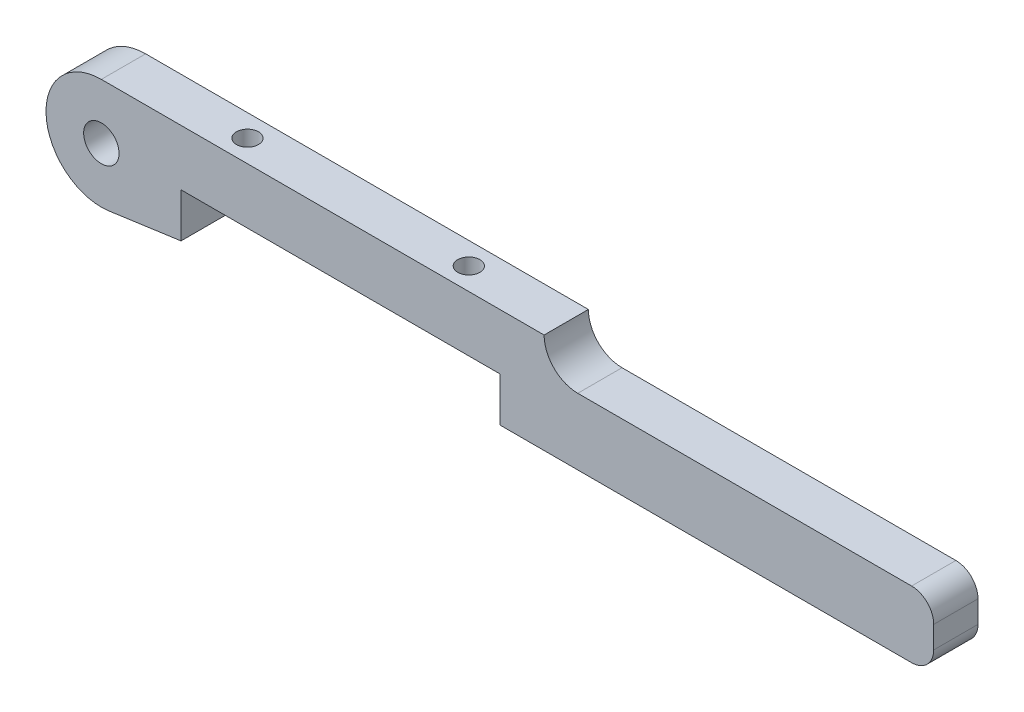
SolidWorks part; units mm, degrees
ref_plane "Front Plane" through (0, 0, 0) normal (0, 0, 1) x (1, 0, 0)
ref_plane "Top Plane" through (0, 0, 0) normal (0, 1, 0) x (1, 0, 0)
ref_plane "Right Plane" through (0, 0, 0) normal (1, 0, 0) x (0, 0, -1)
sketch "Sketch1" plane through (0, 0, 0) normal (0, 0, 1) x (1, 0, 0)
  line L0 (-455.756, 0) -> (22332.0433, 0) construction
  line L1 (0, -455.756) -> (0, 22332.0433) construction
  line L2 (0, 15.875) -> (127, 15.875)
  line L4 (136.652, 6.223) -> (232.41, 6.223)
  line L5 (238.76, -0.127) -> (238.76, -6.477)
  line L6 (232.41, -12.827) -> (114.3, -12.827)
  line L7 (114.3, -12.827) -> (114.3, -0.127)
  line L8 (114.3, -0.127) -> (22.86, -0.127)
  line L9 (22.86, -0.127) -> (22.86, -12.827)
  line L10 (22.86, -12.827) -> (2.2028, -15.7214)
  circle A0 centre (0, 0) radius 5.08
  arc A1 (0, 15.875) -> (2.2028, -15.7214) centre (0, 0) ccw
  arc A2 (238.76, -6.477) -> (232.41, -12.827) centre (232.41, -6.477) cw
  arc A3 (232.41, 6.223) -> (238.76, -0.127) centre (232.41, -0.127) cw
  arc A4 (127, 15.875) -> (136.652, 6.223) centre (136.652, 15.875) ccw
  dimension "D1" = 10.16
  dimension "D2" = 31.75
  dimension "D10" = 6.35
  dimension "D3" = 238.76
  dimension "D4" = 127
  dimension "D6" = 28.702
  dimension "D7" = 12.7
  dimension "D8" = 22.86
  dimension "D9" = 114.3
  dimension "D11" = 9.652
extrude "Boss-Extrude1" add sketch "Sketch1" along normal mid plane 12.7
sketch "Sketch2" plane through (0, 15.875, 0) normal (0, 1, 0) x (1, 0, 0)
  line L1 (22.86, -6.35) -> (22.86, 6.35) construction
  circle A0 centre (35.56, 0) radius 3.175
  circle A1 centre (99.06, 0) radius 3.175
  dimension "D1" = 6.35
  dimension "D2" = 12.7
  dimension "D3" = 63.5
extrude "Cut-Extrude1" cut sketch "Sketch2" against normal blind 29.972
sketch "Sketch3" plane through (0, -0.127, 0) normal (0, -1, 0) x (1, 0, 0)
  line L0 (22.86, 0) -> (35.56, 0) construction
  line L1 (22.86, 6.35) -> (22.86, -6.35) construction
  line L2 (35.56, 0) -> (99.06, 0) construction
  line L3 (35.56, 0) -> (35.56, 6.35) construction
  line L4 (22.86, 6.35) -> (114.3, 6.35) construction
